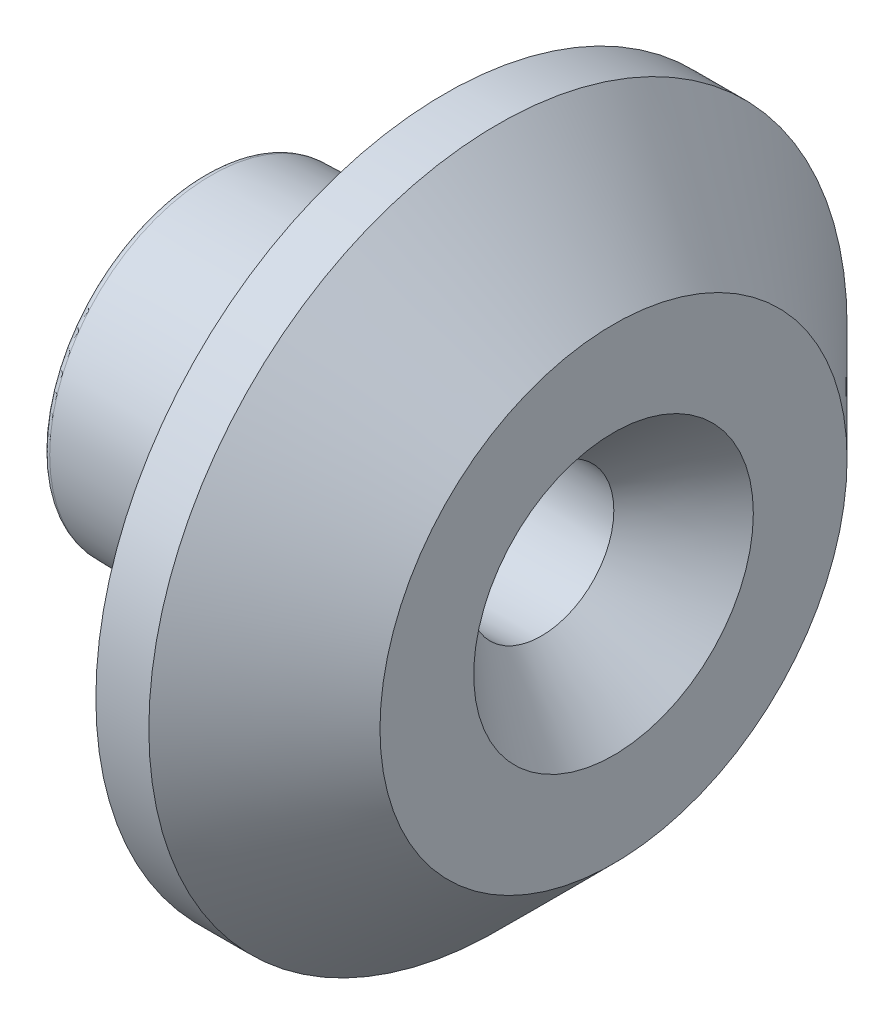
SolidWorks part; units mm, degrees
ref_plane "Plan de face" through (0, 0, 0) normal (0, 0, 1) x (1, 0, 0)
ref_plane "Plan de dessus" through (0, 0, 0) normal (0, 1, 0) x (1, 0, 0)
ref_plane "Plan de droite" through (0, 0, 0) normal (1, 0, 0) x (0, 0, -1)
sketch "Esquisse1" plane through (0, 0, 0) normal (0, 0, 1) x (1, 0, 0)
  line L0 (-10, 0) -> (-10, 6.7)
  line L1 (-10, 6.7) -> (0, 7)
  line L2 (0, 7) -> (0, 14.5)
  line L3 (0, 14.5) -> (2.2, 14.5)
  line L4 (2.2, 14.5) -> (7, 9.7)
  line L5 (7, 9.7) -> (7, 0)
  line L6 (-64.7387, 0) -> (-27.5837, 0) construction
  line L7 (-10, 0) -> (7, 0)
  line L8 (55, 0) -> (-55, 0) construction
  line L9 (0, -55) -> (0, 55) construction
  dimension "D1" = 6.7
  dimension "D2" = 7
  dimension "D3" = 45
  dimension "D4" = 14.5
  dimension "D5" = 10
  dimension "D6" = 7
  dimension "D7" = 2.2
revolve "Révolution1" add sketch "Esquisse1" angle 360 about L6
sketch "Esquisse5" plane through (0, 0, 0) normal (0, 0, 1) x (1, 0, 0)
  line L0 (0, 14.5) -> (0, -14.5) construction
  line L1 (0, 7) -> (2, 7)
  line L2 (0, 7) -> (0, 12)
  line L3 (0, 12) -> (2, 12)
  line L4 (2, 7) -> (2, 12)
  line L5 (2.2, 14.5) -> (0, 14.5) construction
  line L6 (-53.2212, 0) -> (15.7617, 0) construction
  line L7 (9.35, 0) -> (-9.35, 0) construction
  dimension "D1" = 2
  dimension "D2" = 2.5
revolve "Enlèvement de matière-Révolution3" cut sketch "Esquisse5" angle 360 about L6
fillet "Congé3" radius 0.3 3 edges at (-10, 0, 6.7) (2, 0, 7) (2, 0, 12)
sketch "Esquisse6" plane through (-10, 0, 0) normal (-1, 0, 0) x (0, 0, 1)
  circle A0 centre (0, 0) radius 3.5
  dimension "D1" = 7
extrude "Enlèv. mat.-Extru.2" cut sketch "Esquisse6" against normal through all draft 2
fillet "Congé4" radius 0.2 1 edges at (-10, 0, 3.5)
chamfer "Chanfrein3" distance 3 angle 45 1 edges at (7, 0, 2.9063)
scale "Echelle1" scale about origin uniform scaling yes scale factor 1.015
